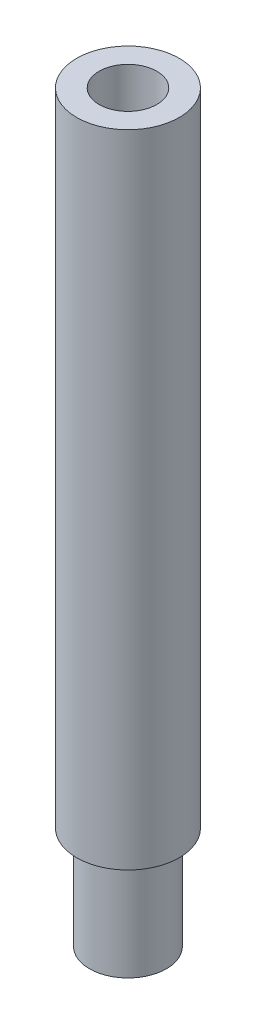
SolidWorks part; units mm, degrees
ref_plane "Front Plane" through (0, 0, 0) normal (0, 0, 1) x (1, 0, 0)
ref_plane "Top Plane" through (0, 0, 0) normal (0, 1, 0) x (1, 0, 0)
ref_plane "Right Plane" through (0, 0, 0) normal (1, 0, 0) x (0, 0, -1)
sketch "Sketch1" plane through (0, 0, 0) normal (0, 0, 1) x (1, 0, 0)
  line L0 (0, 0) -> (9.525, 0)
  line L1 (9.525, 0) -> (9.525, 25.4)
  line L2 (9.525, 25.4) -> (12.7, 25.4)
  line L3 (12.7, 25.4) -> (12.7, 184.15)
  line L4 (12.7, 184.15) -> (7.1437, 184.15)
  line L5 (7.1437, 184.15) -> (7.1437, 155.575)
  line L6 (7.1437, 155.575) -> (0, 155.575)
  line L7 (0, 155.575) -> (0, 0)
  line L8 (0, 0) -> (0, -16.0259) construction
  dimension "D1" = 19.05
  dimension "D2" = 25.4
  dimension "D3" = 158.75
  dimension "D4" = 25.4
  dimension "D5" = 14.2875
  dimension "D6" = 28.575
revolve "Revolve1" add sketch "Sketch1" angle 360 about L8
hole_wizard "5/16-24 Tapped Hole1" positions "Sketch3" profile "Sketch2" tap size "5/16-24" standard "Example Inch"
sketch "Sketch3" plane through (0, 0, 0) normal (0, -1, 0) x (1, 0, 0)
  point P0 (0, 0)
sketch "Sketch2" plane through (0, 0, 0) normal (1, 0, 0) x (0, 0, -1)
  line L0 (0, 0) -> (0, 23.4116)
  line L1 (0, 23.4116) -> (3.4544, 21.336)
  line L2 (3.4544, 21.336) -> (3.4544, 0)
  line L5 (3.4544, 0) -> (0, 0)
  line L10 (0, 23.4116) -> (-3.4544, 21.336) construction
  line L11 (0, -6.35) -> (0, 107.95) construction
  dimension "Tap Drill Dia." = 6.9088
  dimension "Tap Drill Depth" = 21.336
  dimension "Drill Angle" = 118
